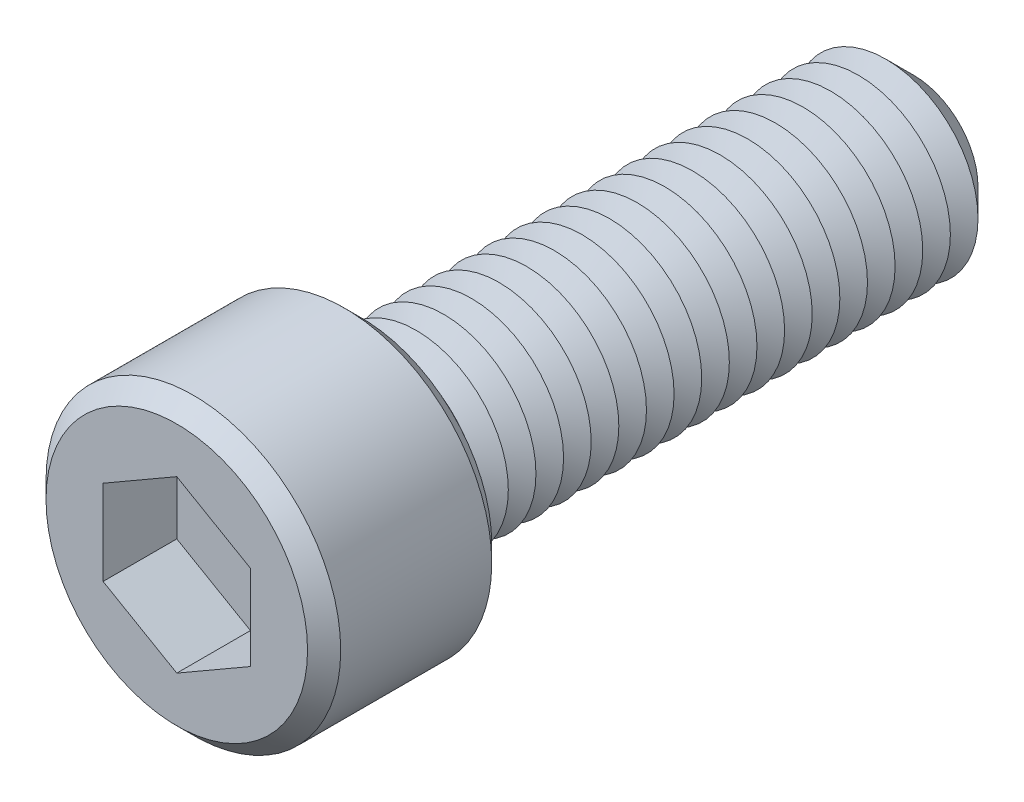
SolidWorks part; units mm, degrees
ref_plane "Front Plane" through (0, 0, 0) normal (0, 0, 1) x (1, 0, 0)
ref_plane "Top Plane" through (0, 0, 0) normal (0, 1, 0) x (1, 0, 0)
ref_plane "Right Plane" through (0, 0, 0) normal (1, 0, 0) x (0, 0, -1)
sketch "Sketch1" plane through (0, 0, 0) normal (0, 0, 1) x (1, 0, 0)
  circle A0 centre (0, 0) radius 8
  dimension "D1" = 16
extrude "Boss-Extrude1" add sketch "Sketch1" along normal blind 10
sketch "Sketch2" plane through (0, 0, 0) normal (0, 0, -1) x (-1, 0, 0)
  circle A0 centre (0, 0) radius 5
  dimension "D1" = 10
extrude "Boss-Extrude2" add sketch "Sketch2" along normal blind 30
chamfer "Chamfer1" distance 1.5 angle 45 1 edges at (-5, 0, -30)
sketch "Sketch3" plane through (0, 0, 0) normal (1, 0, 0) x (0, 0, -1)
  line L0 (-2.5121, 0) -> (4.5776, 0) construction
sketch "Sketch4" plane through (0, 0, 0) normal (1, 0, 0) x (0, 0, -1)
  line L0 (0, 5) -> (0.75, 3.701)
  line L1 (0.75, 3.701) -> (1.5, 5)
  line L2 (28.5, 5) -> (0, 5) construction
  line L3 (1.5, 5) -> (0, 5)
  dimension "D1" = 1.5
revolve "Cut-Revolve1" cut sketch "Sketch4" angle 360 about L0
pattern_linear "LPattern1" count 19 spacing 1.5 along (0, 0, -1) of "Cut-Revolve1"
sketch "Sketch5" plane through (0, 0, 10) normal (0, 0, 1) x (1, 0, 0)
  line L1 (0, 4.6188) -> (-4, 2.3094)
  line L2 (-4, 2.3094) -> (-4, -2.3094)
  line L3 (-4, -2.3094) -> (0, -4.6188)
  line L4 (0, -4.6188) -> (4, -2.3094)
  line L5 (4, -2.3094) -> (4, 2.3094)
  line L6 (4, 2.3094) -> (0, 4.6188)
  circle A0 centre (0, 0) radius 4 construction
  dimension "D1" = 8
extrude "Cut-Extrude1" cut sketch "Sketch5" against normal blind 4
sketch "Sketch6" plane through (0, 0, 6) normal (0, 0, 1) x (1, 0, 0)
  circle A0 centre (0, 0) radius 0.9
  dimension "D1" = 1.8
extrude "Cut-Extrude2" cut sketch "Sketch6" against normal up to surface (36 mm away)
chamfer "Chamfer2" distance 0.9 angle 45 2 edges at (8, 0, 0) (8, 0, 10)
